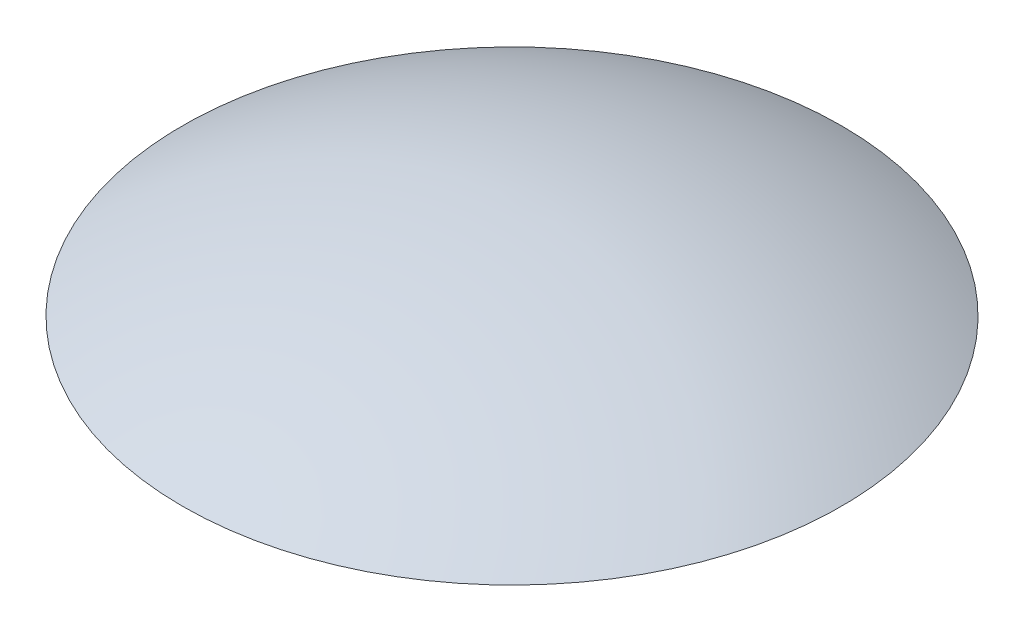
SolidWorks part; units mm, degrees
ref_plane "Front Plane" through (0, 0, 0) normal (0, 0, 1) x (1, 0, 0)
ref_plane "Top Plane" through (0, 0, 0) normal (0, 1, 0) x (1, 0, 0)
ref_plane "Right Plane" through (0, 0, 0) normal (1, 0, 0) x (0, 0, -1)
sketch "Sketch2" plane through (0, 0, 0) normal (1, 0, 0) x (0, 0, -1)
  line L0 (0, 0) -> (-7.5, 0)
  line L1 (0, 2) -> (0, 0)
  line L2 (0, 0) -> (0, -43.7488) construction
  line L3 (0, 2) -> (34.8231, 2) construction
  arc A0 (-7.5, 0) -> (0, 2) centre (0, -13.0625) cw
  dimension "D1" = 2
  dimension "D2" = 7.5
revolve "Revolve1" add sketch "Sketch2" angle 360 about L2
sketch "Sketch3" plane through (0, 0, 0) normal (0, -1, 0) x (1, 0, 0)
  line L0 (0.75, 3) -> (0.75, 0.75)
  line L1 (-3, 0.75) -> (3, 0.75) construction
  line L2 (-3, 0.75) -> (-3, -0.75)
  line L3 (-3, -0.75) -> (3, -0.75) construction
  line L4 (3, 0.75) -> (3, -0.75)
  line L5 (-3, 0.75) -> (3, -0.75) construction
  line L6 (-3, -0.75) -> (3, 0.75) construction
  line L7 (-0.75, 3) -> (0.75, 3)
  line L8 (-0.75, 3) -> (-0.75, -3) construction
  line L9 (-0.75, -3) -> (0.75, -3)
  line L10 (0.75, 3) -> (0.75, -3) construction
  line L11 (-0.75, 3) -> (0.75, -3) construction
  line L12 (-0.75, -3) -> (0.75, 3) construction
  line L13 (0.75, 0.75) -> (3, 0.75)
  line L14 (3, -0.75) -> (0.75, -0.75)
  line L15 (0.75, -0.75) -> (0.75, -3)
  line L16 (-0.75, -3) -> (-0.75, -0.75)
  line L17 (-0.75, -0.75) -> (-3, -0.75)
  line L18 (-3, 0.75) -> (-0.75, 0.75)
  line L19 (-0.75, 0.75) -> (-0.75, 3)
  line L20 (-0.75, 3) -> (-0.7282, 2.9911)
  point P0 (0, 0)
  point P6 (0, 0)
  dimension "D1" = 1.5
  dimension "D2" = 1.5
  dimension "D3" = 6
  dimension "D4" = 6
extrude "Boss-Extrude1" add sketch "Sketch3" along normal blind 2 draft 5
